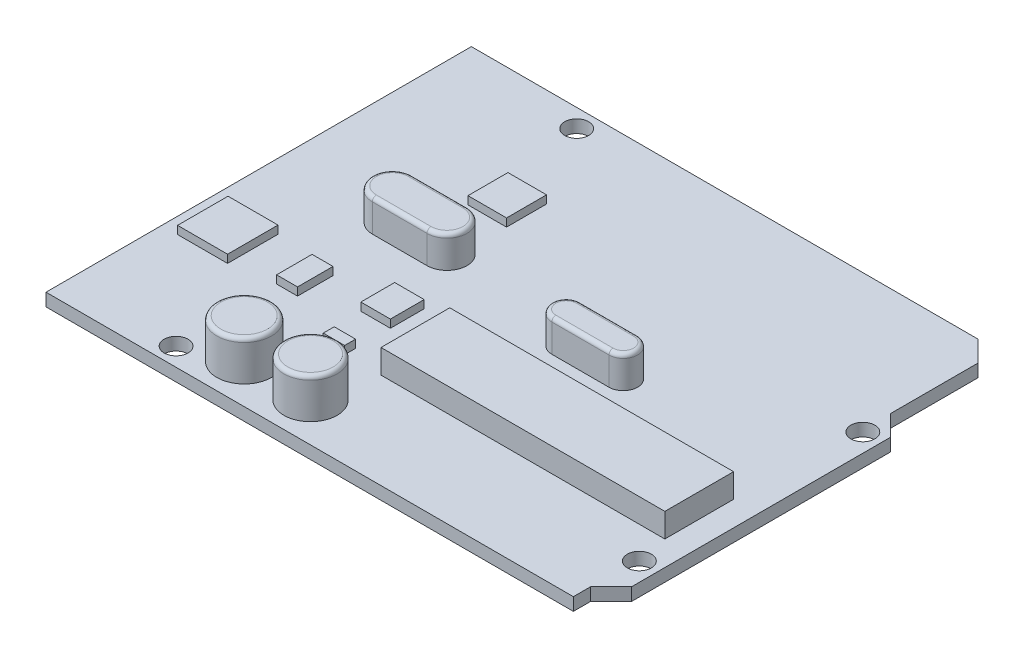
SolidWorks part; units mm, degrees
ref_plane "Alzado" through (0, 0, 0) normal (0, 0, 1) x (1, 0, 0)
ref_plane "Planta" through (0, 0, 0) normal (0, 1, 0) x (1, 0, 0)
ref_plane "Vista lateral" through (0, 0, 0) normal (1, 0, 0) x (0, 0, -1)
sketch "Croquis1" plane through (0, 0, 0) normal (0, 1, 0) x (1, 0, 0)
  line L0 (0, 53.3) -> (66.08, 53.3)
  line L1 (66.08, 53.3) -> (66.08, 39.7388)
  line L2 (66.08, 39.7388) -> (68.65, 39.7388)
  line L3 (68.65, 39.7388) -> (68.65, 2.1388)
  line L4 (68.65, 2.1388) -> (66.08, 2.1388)
  line L5 (66.08, 2.1388) -> (66.08, 0)
  line L6 (66.08, 0) -> (0, 0)
  line L7 (0, 0) -> (0, 53.3)
  dimension "D1" = 68.65
  dimension "D2" = 53.3
  dimension "D3" = 66.08
  dimension "D4" = 37.6
  dimension "D5" = 2.1388
extrude "Saliente-Extruir1" add sketch "Croquis1" along normal blind 1.6
chamfer "Chaflán1" distance 2.6 angle 45 3 edges at (68.65, 0.8, -39.7388) (68.65, 0.8, -2.1388) (66.08, 0.8, -53.3)
sketch "Croquis2" plane through (0, 1.6, 0) normal (0, 1, 0) x (1, 0, 0)
  line L0 (68.65, 4.7388) -> (68.65, 37.1388) construction
  line L1 (0, 0) -> (66.08, 0) construction
  line L2 (0, 53.3) -> (0, 0) construction
  line L3 (63.48, 53.3) -> (0, 53.3) construction
  circle A0 centre (15.5, 51) radius 1.5
  circle A1 centre (66.35, 36) radius 1.5
  circle A2 centre (66.35, 8) radius 1.5
  circle A3 centre (14, 2.3) radius 1.5
  dimension "D1" = 3
  dimension "D2" = 2.3
  dimension "D3" = 28
  dimension "D4" = 8
  dimension "D6" = 14
  dimension "D8" = 2.3
  dimension "D5" = 15.5
  dimension "D7" = 2.3
extrude "Cortar-Extruir1" cut sketch "Croquis2" against normal through all
sketch "Croquis3" plane through (0, 1.6, 0) normal (0, 1, 0) x (1, 0, 0)
  line L1 (65.554, 20.6011) -> (29.989, 20.6011)
  line L2 (65.554, 20.6011) -> (65.554, 11.9877)
  line L3 (65.554, 11.9877) -> (29.989, 11.9877)
  line L4 (29.989, 20.6011) -> (29.989, 11.9877)
extrude "Saliente-Extruir2" add sketch "Croquis3" along normal blind 3
sketch "Croquis4" plane through (0, 1.6, 0) normal (0, 1, 0) x (1, 0, 0)
  circle A0 centre (28.2704, 4.8746) radius 3.3367
  circle A1 centre (19.9601, 4.8746) radius 3.4266
extrude "Saliente-Extruir3" add sketch "Croquis4" along normal blind 5
sketch "Croquis5" plane through (0, 1.6, 0) normal (0, 1, 0) x (1, 0, 0)
  line L1 (1.9892, 20.8199) -> (8.2526, 20.8199)
  line L2 (1.9892, 20.8199) -> (1.9892, 14.4968)
  line L3 (1.9892, 14.4968) -> (8.2526, 14.4968)
  line L4 (8.2526, 20.8199) -> (8.2526, 14.4968)
  line L5 (21.7935, 21.8936) -> (25.4919, 21.8936)
  line L6 (21.7935, 21.8936) -> (21.7935, 17.6583)
  line L7 (21.7935, 17.6583) -> (25.4919, 17.6583)
  line L8 (25.4919, 21.8936) -> (25.4919, 17.6583)
  line L9 (16.1862, 19.776) -> (13.5616, 19.776)
  line L10 (16.1862, 19.776) -> (16.1862, 15.3319)
  line L11 (16.1862, 15.3319) -> (13.5616, 15.3319)
  line L12 (13.5616, 19.776) -> (13.5616, 15.3319)
  line L13 (25.4919, 13.3038) -> (22.8075, 13.3038)
  line L14 (25.4919, 13.3038) -> (25.4919, 11.9318)
  line L15 (25.4919, 11.9318) -> (22.8075, 11.9318)
  line L16 (22.8075, 13.3038) -> (22.8075, 11.9318)
  line L17 (21.7935, 40.9224) -> (16.9617, 40.9224)
  line L18 (21.7935, 40.9224) -> (21.7935, 35.9117)
  line L19 (21.7935, 35.9117) -> (16.9617, 35.9117)
  line L20 (16.9617, 40.9224) -> (16.9617, 35.9117)
extrude "Saliente-Extruir4" add sketch "Croquis5" along normal blind 1
sketch "Croquis6" plane through (0, 1.6, 0) normal (0, 1, 0) x (1, 0, 0)
  line L0 (14.1447, 29.2524) -> (20.9913, 29.2524) construction
  line L1 (14.1447, 31.7572) -> (20.9913, 31.7572)
  line L2 (14.1447, 26.7475) -> (20.9913, 26.7475)
  line L3 (38.4312, 26.7475) -> (45.5901, 26.7475) construction
  line L4 (38.4312, 28.5409) -> (45.5901, 28.5409)
  line L5 (38.4312, 24.9541) -> (45.5901, 24.9541)
  arc A0 (14.1447, 31.7572) -> (14.1447, 26.7475) centre (14.1447, 29.2524) ccw
  arc A1 (20.9913, 26.7475) -> (20.9913, 31.7572) centre (20.9913, 29.2524) ccw
  arc A2 (38.4312, 28.5409) -> (38.4312, 24.9541) centre (38.4312, 26.7475) ccw
  arc A3 (45.5901, 24.9541) -> (45.5901, 28.5409) centre (45.5901, 26.7475) ccw
  point P2 (17.568, 29.2524)
  point P9 (42.0106, 26.7475)
extrude "Saliente-Extruir5" add sketch "Croquis6" along normal blind 4
fillet "Redondeo1" radius 0.5 10 edges at (28.2704, 6.6, -1.5379) (19.9601, 6.6, -1.448) (42.0106, 5.6, -28.5409) (47.3836, 5.6, -26.7475) (42.0106, 5.6, -24.9541) (36.6377, 5.6, -26.7475) (17.568, 5.6, -31.7572) (23.4962, 5.6, -29.2524) (17.568, 5.6, -26.7475) (11.6398, 5.6, -29.2524)
